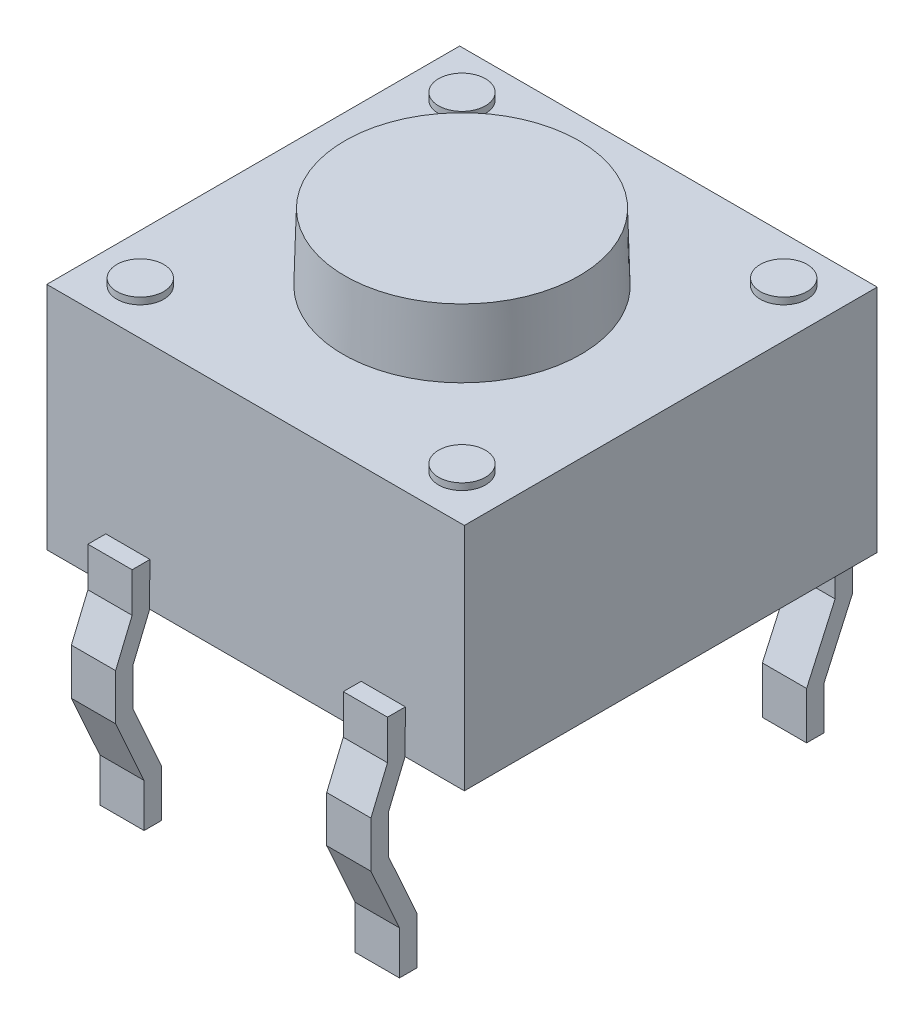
SolidWorks part; units mm, degrees
ref_plane "Plan de face" through (0, 0, 0) normal (0, 0, 1) x (1, 0, 0)
ref_plane "Plan de dessus" through (0, 0, 0) normal (0, 1, 0) x (1, 0, 0)
ref_plane "Plan de droite" through (0, 0, 0) normal (1, 0, 0) x (0, 0, -1)
sketch "Esquisse1" plane through (0, 0, 0) normal (0, 1, 0) x (1, 0, 0)
  line L0 (0, 0) -> (0, 3.08) construction
  line L1 (-3.115, -3.08) -> (3.115, -3.08)
  line L2 (-3.115, -3.08) -> (-3.115, 3.08)
  line L3 (-3.115, 3.08) -> (3.115, 3.08)
  line L4 (3.115, -3.08) -> (3.115, 3.08)
  line L5 (0, 3.08) -> (3.115, 0) construction
  line L6 (3.115, 0) -> (0, 0) construction
  dimension "D1" = 6.23
  dimension "D2" = 6.16
extrude "Extrusion1" add sketch "Esquisse1" along normal blind 3.43
sketch "Esquisse3" plane through (0, 0, 3.08) normal (0, 0, 1) x (1, 0, 0)
  line L0 (0, -1.7296) -> (0, 2.2567) construction
  line L1 (1.575, 0.6459) -> (2.235, 0.6459)
  line L2 (1.575, 0.6459) -> (1.575, 0.3844)
  line L3 (1.575, 0.3844) -> (2.235, 0.3844)
  line L4 (2.235, 0.6459) -> (2.235, 0.3844)
  line L5 (1.905, 2.2567) -> (1.905, -1.7296) construction
  line L6 (1.575, -0.6236) -> (1.575, 1.1812) construction
  line L7 (2.235, -0.9882) -> (2.235, 1.5214) construction
  line L8 (3.2331, 0.3844) -> (1.2877, 0.3844) construction
  line L9 (3.2331, 0.6459) -> (1.2877, 0.6459) construction
  line L10 (3.1577, 0.5144) -> (1.3675, 0.5144) construction
  dimension "D1" = 1.905
  dimension "D2" = 0.33
  dimension "D3" = 0.33
  dimension "D4" = 0.13
ref_plane "Plan1" through (1.575, 0, 0) normal (1, 0, 0) x (0, 0, -1)
sketch "Esquisse4" plane through (1.575, 0, 0) normal (1, 0, 0) x (0, 0, -1)
  line L0 (-2.8776, 0.5029) -> (-3.2037, 0.5029)
  line L2 (-3.2037, 0.5029) -> (-3.2037, 0.0279)
  line L3 (-3.2037, 0.0279) -> (-3.4504, -0.5632)
  line L4 (-3.4504, -0.5632) -> (-3.4504, -1.1911)
  line L5 (-3.4504, -1.1911) -> (-3.0253, -2.1355)
  line L6 (-3.0253, -2.1355) -> (-3.0253, -2.8138)
  line L7 (0, 0.0322) -> (0, -3.2332) construction
  line L8 (-3.125, -1.0945) -> (-3.125, -3.4532) construction
  line L9 (-5.6151, -2.8138) -> (2.1799, -2.8138) construction
  line L10 (-3.6368, 0.1862) -> (-5.7176, 0.1862) construction
  line L11 (-4.0388, -1.8138) -> (2.3927, -1.8138) construction
  dimension "D1" = 3.125
  dimension "D2" = 3
  dimension "D3" = 1
sweep "Balayage1" add profiles "Esquisse3" path "Esquisse4"
mirror "Symétrie1" about plane through (0, 0, 0) normal (1, 0, 0) of "Balayage1"
mirror "Symétrie2" about plane through (0, 0, 0) normal (0, 0, 1) of "Symétrie1", "Balayage1"
sketch "Esquisse5" plane through (0, 3.43, 0) normal (0, 1, 0) x (-1, 0, 0)
  line L0 (-2.4, 2.4) -> (2.4, 2.4) construction
  line L1 (2.4, 2.4) -> (2.4, -2.4) construction
  line L2 (2.4, -2.4) -> (-2.4, -2.4) construction
  line L3 (-2.4, -2.4) -> (-2.4, 2.4) construction
  line L4 (0, 0) -> (-2.4, 0) construction
  line L5 (-2.4, 0) -> (0, 2.4) construction
  line L6 (0, 2.4) -> (0, 0) construction
  circle A0 centre (-2.4, 2.4) radius 0.35
  circle A1 centre (-2.4, -2.4) radius 0.35
  circle A2 centre (2.4, -2.4) radius 0.35
  circle A3 centre (2.4, 2.4) radius 0.35
  dimension "D1" = 0.7
extrude "Extrusion3" add sketch "Esquisse5" along normal blind 0.1
sketch "Esquisse6" plane through (0, 0, 0) normal (1, 0, 0) x (0, 0, -1)
  line L0 (0, -0.9176) -> (0, 15.2088) construction
  line L1 (10.1573, 3.43) -> (-5.1045, 3.43) construction
  line L2 (-1.775, 4.3451) -> (-1.775, 3.0106) construction
  line L3 (-3.6385, 4.43) -> (5.8531, 4.43) construction
  line L5 (0, 3.43) -> (-1.775, 3.43)
  line L6 (-1.775, 3.43) -> (-1.7475, 4.43)
  line L8 (0, 4.43) -> (0, 3.43)
  line L9 (-1.7475, 4.43) -> (0, 4.43)
  dimension "D1" = 1.775
  dimension "D3" = 1
revolve "Révolution1" add sketch "Esquisse6" angle 360 about L0
